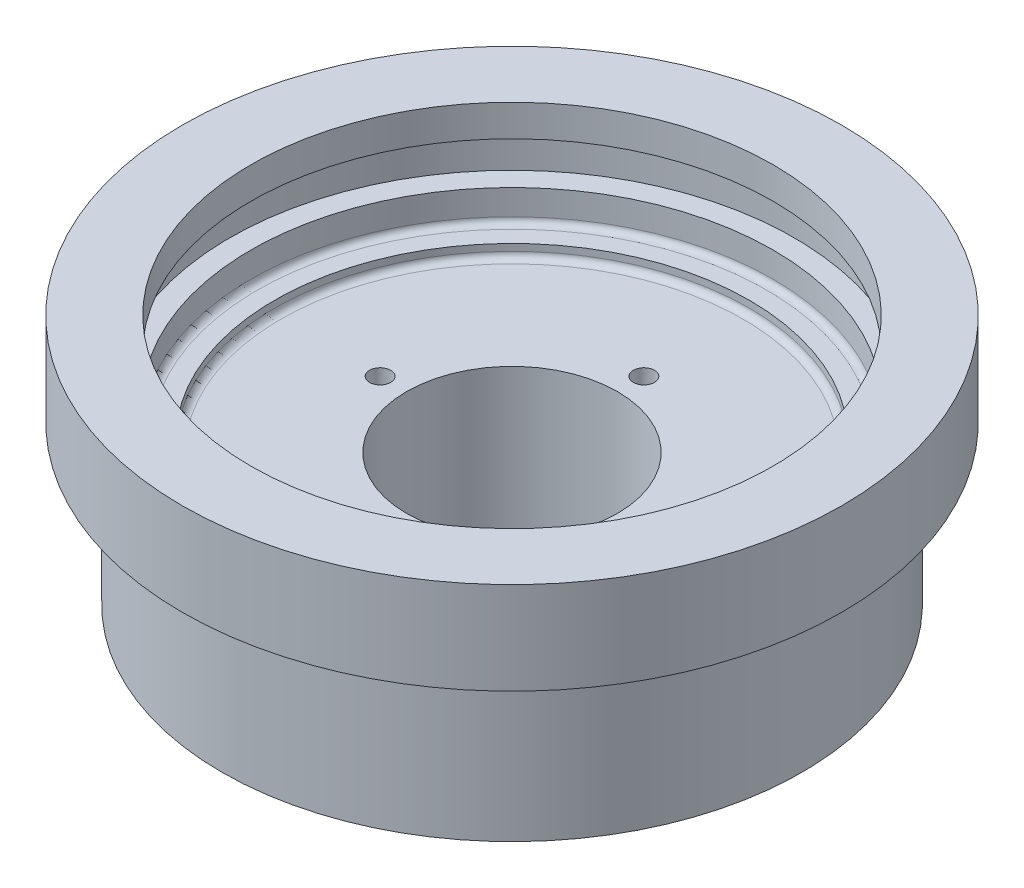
SolidWorks part; units mm, degrees
ref_plane "top" through (0, 0, 0) normal (0, 0, 1) x (1, 0, 0)
ref_plane "front" through (0, 0, 0) normal (0, 1, 0) x (1, 0, 0)
ref_plane "right" through (0, 0, 0) normal (1, 0, 0) x (0, 0, -1)
sketch "Sketch1" plane through (0, 0, 0) normal (0, 0, 1) x (1, 0, 0)
  line L0 (0, 88.7095) -> (0, -91.5035) construction
  line L1 (62.865, 0) -> (79.375, 0)
  line L2 (79.375, 0) -> (79.375, -22.225)
  line L3 (25.4, -63.5) -> (36.5252, -63.5)
  line L4 (36.5252, -60.6806) -> (41.275, -60.6806)
  line L5 (41.275, -60.6806) -> (41.275, -63.5)
  line L6 (41.275, -63.5) -> (62.992, -63.5)
  line L7 (62.992, -63.5) -> (62.992, -61.849)
  line L8 (36.5252, -60.6806) -> (36.5252, -63.5)
  line L9 (64.516, -60.325) -> (69.85, -60.325)
  line L10 (25.4, -63.5) -> (25.4, -28.575)
  line L11 (25.4, -28.575) -> (55.626, -28.575)
  line L12 (57.15, -27.051) -> (57.15, -25.4)
  line L13 (57.15, -25.4) -> (61.341, -25.4)
  line L14 (62.865, -23.876) -> (62.865, -17.78)
  line L15 (62.865, -17.78) -> (67.945, -17.78)
  line L16 (67.945, -17.78) -> (67.945, -7.62)
  line L17 (67.945, -7.62) -> (62.865, -7.62)
  line L18 (62.865, -7.62) -> (62.865, 0)
  line L19 (79.375, -22.225) -> (71.374, -22.225)
  line L20 (69.85, -23.749) -> (69.85, -60.325)
  arc A0 (57.15, -27.051) -> (55.626, -28.575) centre (55.626, -27.051) cw
  arc A1 (64.516, -60.325) -> (62.992, -61.849) centre (64.516, -61.849) ccw
  arc A2 (69.85, -23.749) -> (71.374, -22.225) centre (71.374, -23.749) cw
  arc A3 (62.865, -23.876) -> (61.341, -25.4) centre (61.341, -23.876) cw
  point P23 (57.15, -28.575)
  point P32 (62.865, -25.4)
  dimension "D11" = 1.524
  dimension "D19" = 1.524
  dimension "D20" = 1.524
  dimension "D1" = 69.85
  dimension "D2" = 57.15
  dimension "D3" = 22.225
  dimension "D4" = 62.865
  dimension "D5" = 7.62
  dimension "D6" = 7.62
  dimension "D7" = 10.16
  dimension "D8" = 5.08
  dimension "D9" = 25.4
  dimension "D10" = 3.175
  dimension "D12" = 62.992
  dimension "D13" = 36.5252
  dimension "D14" = 4.7498
  dimension "D15" = 2.8194
  dimension "D16" = 63.5
  dimension "D17" = 79.375
  dimension "D18" = 3.175
revolve "Base-Revolve" add sketch "Sketch1" angle 360 about L0
sketch "Sketch2" plane through (0, -28.575, 0) normal (0, 1, 0) x (-1, 0, 0)
  circle A0 centre (0, 31.75) radius 2.54
  dimension "D1" = 5.08
  dimension "D2" = 31.75
extrude "Cut-Extrude1" cut sketch "Sketch2" against normal through all
pattern_circular "CirPattern1" count 4 every 90 about axis through (0, 88.7095, 0) along (0, -1, 0)
